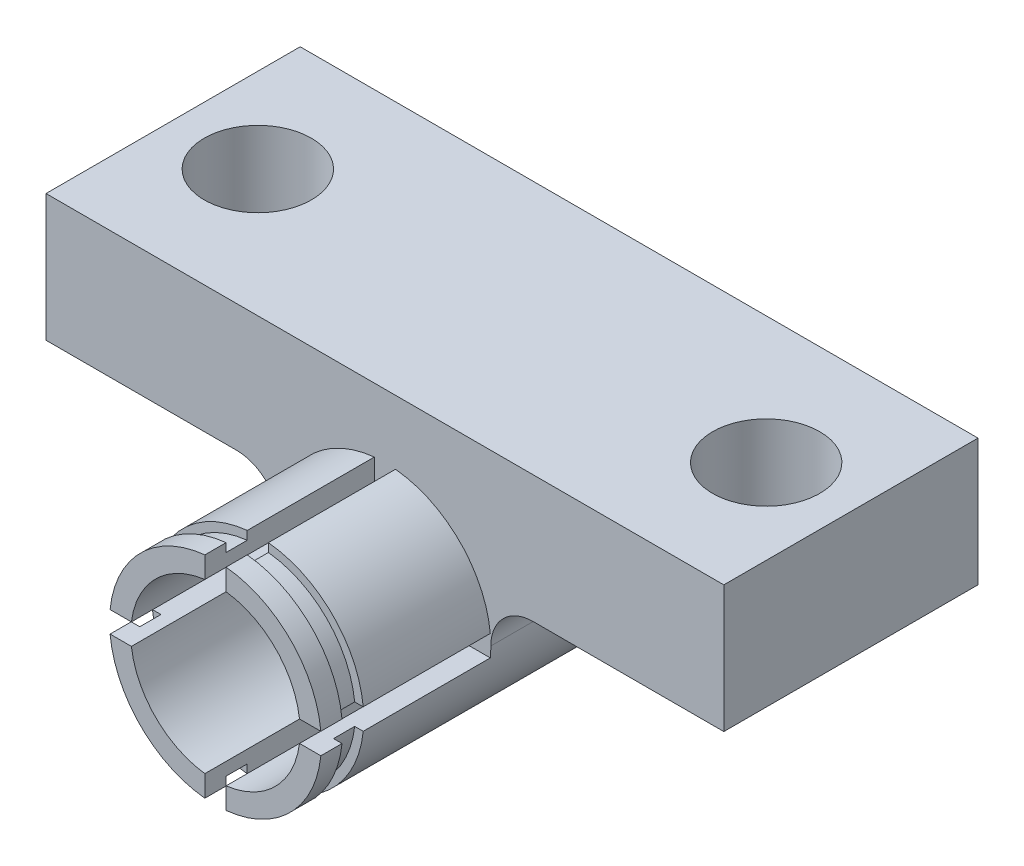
SolidWorks part; units mm, degrees
ref_plane "Front Plane" through (0, 0, 0) normal (0, 0, 1) x (1, 0, 0)
ref_plane "Top Plane" through (0, 0, 0) normal (0, 1, 0) x (1, 0, 0)
ref_plane "Right Plane" through (0, 0, 0) normal (1, 0, 0) x (0, 0, -1)
sketch "Sketch1" plane through (0, 0, 0) normal (0, 1, 0) x (1, 0, 0)
  line L1 (0, 0) -> (50.8, 0)
  line L2 (0, 0) -> (0, 31.75)
  line L3 (0, 31.75) -> (50.8, 31.75)
  line L4 (50.8, 0) -> (50.8, 31.75)
  dimension "D1" = 31.75
  dimension "D2" = 50.8
extrude "Extrude1" add sketch "Sketch1" along normal blind 25.4
sketch "Sketch2" plane through (0, 0, 0) normal (0, 0, 1) x (1, 0, 0)
  line L0 (25.4, 25.4) -> (25.4, 0) construction
  line L1 (0, 25.4) -> (50.8, 25.4) construction
  line L2 (0, 0) -> (50.8, 0) construction
  line L3 (33.3375, 12.7) -> (33.3375, 15.875)
  line L4 (33.3375, 15.875) -> (50.8, 15.875)
  line L6 (50.8, 25.4) -> (50.8, 0) construction
  line L7 (50.8, 25.4) -> (0, 25.4) construction
  line L8 (17.4625, 12.7) -> (17.4625, 15.875)
  line L9 (17.4625, 15.875) -> (0, 15.875)
  line L10 (50.8, 15.875) -> (50.8, 25.4)
  line L11 (50.8, 25.4) -> (0, 25.4)
  line L12 (0, 25.4) -> (0, 15.875)
  arc A0 (17.4625, 12.7) -> (33.3375, 12.7) centre (25.4, 12.7) ccw
  dimension "D1" = 15.875
  dimension "D2" = 12.7
  dimension "D3" = 9.525
extrude "Cut-Extrude1" cut sketch "Sketch2" against normal through all flip side to cut
fillet "Fillet1" radius 3.175 2 edges at (33.3375, 15.875, -15.875) (17.4625, 15.875, -15.875)
sketch "Sketch3" plane through (0, 0, 0) normal (0, 0, 1) x (1, 0, 0)
  circle A0 centre (25.4, 12.7) radius 7.9375
  arc A1 (17.4625, 12.7) -> (33.3375, 12.7) centre (25.4, 12.7) ccw construction
extrude "Cut-Extrude2" cut sketch "Sketch3" against normal blind 12.7 flip side to cut
sketch "Sketch4" plane through (0, 0, 0) normal (0, 0, 1) x (1, 0, 0)
  circle A0 centre (25.4, 12.7) radius 6.35
  dimension "D1" = 12.7
extrude "Cut-Extrude3" cut sketch "Sketch4" against normal through all
ref_plane "Plane1" through (0, 0, -1.5875) normal (0, 0, 1) x (1, 0, 0)
hole_wizard "O (0.316) Diameter Hole1" positions "Sketch8" profile "Sketch7" hole size "O" standard "Ansi Inch"
sketch "Sketch8" plane through (0, 15.875, 0) normal (0, -1, 0) x (1, 0, 0)
  line L0 (0, -22.225) -> (50.8, -22.225) construction
  line L1 (0, -31.75) -> (0, -12.7) construction
  line L2 (50.8, -31.75) -> (50.8, -12.7) construction
  line L3 (25.4, -22.225) -> (25.4, -36.2819) construction
  point P0 (6.35, -22.225)
  point P12 (44.45, -22.225)
  dimension "D1" = 38.1
sketch "Sketch7" plane through (6.35, 15.875, -22.225) normal (1, 0, 0) x (0, 0, -1)
  line L0 (0, 0) -> (0, 9.525)
  line L1 (0, 9.525) -> (4.0132, 9.525)
  line L2 (4.0132, 9.525) -> (4.0132, 0)
  line L5 (4.0132, 0) -> (0, 0)
  line L11 (0, -6.35) -> (0, 107.95) construction
  dimension "Thru Hole Dia." = 8.0264
  dimension "Thru Hole Depth" = 9.525
sketch "Sketch5" plane through (0, 0, 0) normal (0, 0, 1) x (1, 0, 0)
  line L0 (25.4, 20.6375) -> (25.4, 4.7625) construction
  line L1 (32.207, 12.7) -> (17.4625, 12.7) construction
  line L2 (26.1938, 13.4938) -> (47.1057, 13.4938)
  line L3 (24.6062, 32.5436) -> (26.1937, 32.5436)
  line L4 (24.6062, 32.5436) -> (24.6062, 13.4938)
  line L5 (24.6062, -16.1269) -> (26.1937, -16.1269)
  line L6 (26.1937, 32.5436) -> (26.1938, 13.4938)
  line L7 (6.087, 13.4938) -> (24.6062, 13.4938)
  line L8 (6.087, 13.4938) -> (6.087, 11.9062)
  line L9 (6.087, 11.9062) -> (24.6062, 11.9062)
  line L10 (47.1057, 13.4938) -> (47.1057, 11.9062)
  line L11 (26.1938, 11.9062) -> (47.1057, 11.9062)
  line L12 (24.6062, 11.9062) -> (24.6062, -16.1269)
  line L13 (26.1938, 11.9062) -> (26.1937, -16.1269)
  circle A0 centre (25.4, 12.7) radius 7.9375 construction
  dimension "D1" = 1.5875
extrude "Cut-Extrude4" cut sketch "Sketch5" against normal blind 12.7
sketch "Sketch6" plane through (0, 0, -1.5875) normal (0, 0, 1) x (1, 0, 0)
  circle A0 centre (25.4, 12.7) radius 7.9375
  circle A1 centre (25.4, 12.7) radius 7.3025
  circle A2 centre (25.4, 12.7) radius 7.9375 construction
  dimension "D1" = 0.635
extrude "Cut-Extrude5" cut sketch "Sketch6" against normal blind 1.5875
